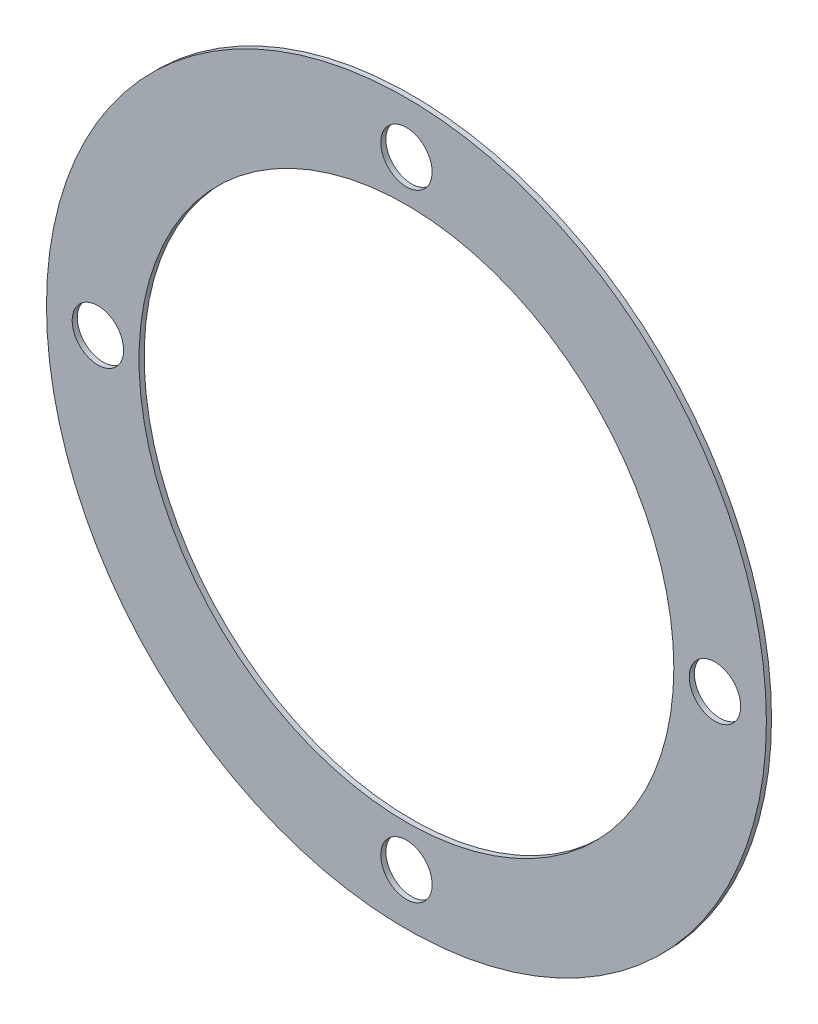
SolidWorks part; units mm, degrees
ref_plane "face" through (0, 0, 0) normal (0, 0, 1) x (1, 0, 0)
ref_plane "dessus" through (0, 0, 0) normal (0, 1, 0) x (1, 0, 0)
ref_plane "profil" through (0, 0, 0) normal (1, 0, 0) x (0, 0, -1)
sketch "Esquisse1" plane through (0, 0, 0) normal (0, 0, 1) x (1, 0, 0)
  circle A0 centre (0, 0) radius 35
  circle A1 centre (0, 0) radius 26
  dimension "D1" = 52
  dimension "D2" = 70
extrude "Base-Extrusion" add sketch "Esquisse1" along normal blind 0.5
sketch "Esquisse2" plane through (0, 0, 0.5) normal (0, 0, 1) x (1, 0, 0)
  circle A0 centre (0, 30) radius 2.5
  dimension "D1" = 5
  dimension "D2" = 30
extrude "Enlèv. mat.-Extru.1" cut sketch "Esquisse2" against normal through all
pattern_circular "Répétition circulaire1" count 4 over 360
